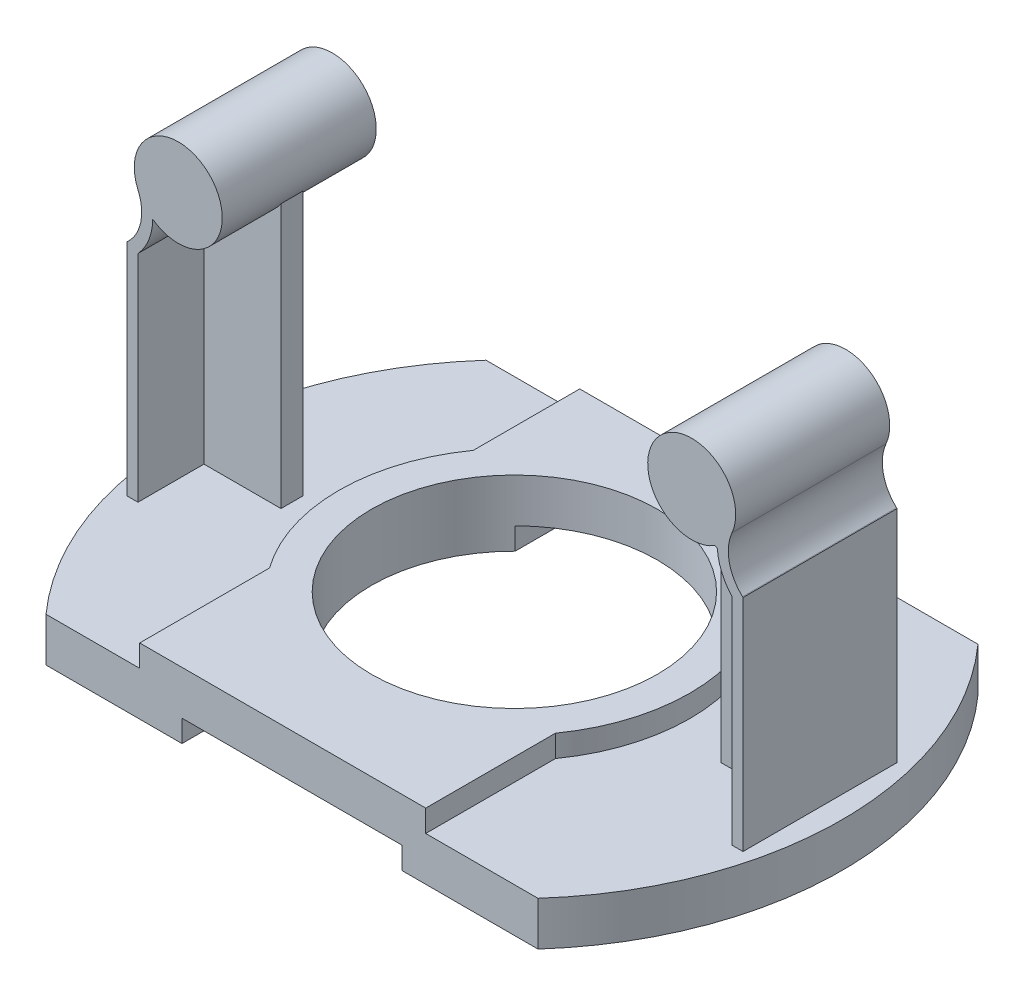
SolidWorks part; units mm, degrees
ref_plane "Plan de face" through (0, 0, 0) normal (0, 0, 1) x (1, 0, 0)
ref_plane "Plan de dessus" through (0, 0, 0) normal (0, 1, 0) x (1, 0, 0)
ref_plane "Plan de droite" through (0, 0, 0) normal (1, 0, 0) x (0, 0, -1)
sketch "Esquisse1" plane through (0, 0, 0) normal (0, 0, 1) x (1, 0, 0)
  line L0 (-14, 0) -> (-10, 0)
  line L1 (-14, 0) -> (-14, 10)
  line L2 (-14, 10) -> (-12.5685, 11.3164)
  line L3 (-10, 0) -> (-10, 12)
  line L4 (10, 0) -> (10, 12)
  line L5 (14, 10) -> (12.5685, 11.3164)
  line L6 (0, 12) -> (0, -7.2956) construction
  line L7 (14, 0) -> (14, 10)
  line L8 (14, 0) -> (10, 0)
  arc A0 (-10, 12) -> (-12.5685, 11.3164) centre (-11.6687, 13.1025) ccw
  arc A1 (10, 12) -> (12.5685, 11.3164) centre (11.6687, 13.1025) cw
  dimension "D1" = 4
  dimension "D2" = 4
  dimension "D3" = 10
  dimension "D4" = 12
  dimension "D5" = 14
extrude "Boss.-Extru.1" add sketch "Esquisse1" along normal blind 7
fillet "Congé1" radius 2 1 edges at (-12.5685, 11.3164, 3.5)
sketch "Esquisse2" plane through (0, 0, 7) normal (0, 0, 1) x (1, 0, 0)
  line L0 (-10, 12) -> (-10, 0)
  line L1 (-10, 0) -> (-13.5, 0)
  line L2 (-13.5, 10) -> (-13.5, 0)
  line L3 (-13.5, 9.7909) -> (-13.5, 0)
  line L4 (0, 15.4181) -> (0, -6.3433) construction
  line L5 (-10, 0) -> (-10, 12) construction
  arc A1 (-12.8308, 11.4748) -> (-10, 12) centre (-11.6687, 13.1025) ccw
  arc A2 (-13.6385, 9.6532) -> (-13.0419, 12.4991) centre (-15.3307, 11.4934) ccw
  arc A3 (-13.5, 9.7909) -> (-12.8308, 11.4748) centre (-15.3307, 11.4934) ccw
  dimension "D3" = 4
  dimension "D1" = 0.5
  dimension "D2" = 0.5
extrude "Enlèv. mat.-Extru.2" cut sketch "Esquisse2" against normal blind 3
sketch "Esquisse5" plane through (0, 0, 0) normal (0, 0, -1) x (-1, 0, 0)
  line L6 (13.5, 0) -> (13.5, 9.7909)
  line L7 (10, 0) -> (13.5, 0)
  line L8 (10, 12) -> (10, 0)
  line L9 (13.5, 0) -> (13.5, 9.7909)
  line L10 (10, 0) -> (13.5, 0)
  line L11 (10, 12) -> (10, 0)
  arc A5 (12.8308, 11.4748) -> (13.5, 9.7909) centre (15.3307, 11.4934) ccw
  arc A6 (12.8308, 11.4748) -> (13.5, 9.7909) centre (15.3307, 11.4934) ccw
  arc A7 (10, 12) -> (12.8308, 11.4748) centre (11.6687, 13.1025) ccw
  arc A8 (10, 12) -> (12.8308, 11.4748) centre (11.6687, 13.1025) ccw
  dimension "D1" = 0
extrude "Enlèv. mat.-Extru.3" cut sketch "Esquisse5" against normal blind 3
fillet "Congé3" radius 2 1 edges at (12.5685, 11.3164, 3.5)
sketch "Esquisse6" plane through (0, 0, 7) normal (0, 0, 1) x (1, 0, 0)
  line L0 (0, 14.8412) -> (0, -11.2056) construction
  line L1 (10, 0) -> (10, 12)
  line L2 (13.5, 0) -> (10, 0)
  line L3 (13.5, 9.7909) -> (13.5, 0)
  line L4 (-13.5, 9.7909) -> (-13.5, 0)
  line L5 (-13.5, 0) -> (-10, 0)
  line L6 (-10, 0) -> (-10, 12)
  line L7 (-13.5, 9.7909) -> (-13.5, 0)
  line L8 (-13.5, 0) -> (-10, 0)
  line L9 (-10, 0) -> (-10, 12)
  arc A0 (12.6876, 11.3833) -> (12.8382, 11.3049) centre (12.7385, 11.2972) cw
  arc A1 (12.6876, 11.3833) -> (10, 12) centre (11.6687, 13.1074) cw
  arc A2 (13.5, 9.7909) -> (12.8382, 11.3049) centre (15.3311, 11.4929) cw
  arc A3 (-13.5, 9.7909) -> (-12.8308, 11.4748) centre (-15.3307, 11.4934) ccw
  arc A4 (-13.5, 9.7909) -> (-12.8308, 11.4748) centre (-15.3307, 11.4934) ccw
  arc A5 (-12.8308, 11.4748) -> (-10, 12) centre (-11.6687, 13.1025) ccw
  arc A6 (-12.8308, 11.4748) -> (-10, 12) centre (-11.6687, 13.1025) ccw
  dimension "D1" = 0
extrude "Enlèv. mat.-Extru.4" cut sketch "Esquisse6" against normal blind 3
sketch "Esquisse7" plane through (0, 0, 0) normal (0, 0, -1) x (-1, 0, 0)
  line L3 (-10, 0) -> (-10, 12)
  line L4 (-13.5, 0) -> (-10, 0)
  line L5 (-13.5, 9.7909) -> (-13.5, 0)
  line L6 (-10, 0) -> (-10, 12)
  line L7 (-13.5, 0) -> (-10, 0)
  line L8 (-13.5, 9.7909) -> (-13.5, 0)
  arc A3 (-12.6876, 11.3833) -> (-10, 12) centre (-11.6687, 13.1074) ccw
  arc A4 (-13.5, 9.7909) -> (-12.8382, 11.3049) centre (-15.3311, 11.4929) ccw
  arc A5 (-12.6876, 11.3833) -> (-12.8382, 11.3049) centre (-12.7385, 11.2972) ccw
  arc A6 (-12.6876, 11.3833) -> (-10, 12) centre (-11.6687, 13.1074) ccw
  arc A7 (-13.5, 9.7909) -> (-12.8382, 11.3049) centre (-15.3311, 11.4929) ccw
  arc A8 (-12.6876, 11.3833) -> (-12.8382, 11.3049) centre (-12.7385, 11.2972) ccw
  dimension "D1" = 0
extrude "Enlèv. mat.-Extru.5" cut sketch "Esquisse7" against normal blind 3
sketch "Esquisse8" plane through (0, 0, 0) normal (0, -1, 0) x (1, 0, 0)
  line L0 (-11.1803, -6.5) -> (11.1803, -6.5)
  line L1 (-11.1803, 13.5) -> (11.1803, 13.5)
  arc A0 (11.1803, -6.5) -> (11.1803, 13.5) centre (0, 3.5) ccw
  arc A1 (-11.1803, 13.5) -> (-11.1803, -6.5) centre (0, 3.5) ccw
  dimension "D1" = 30
  dimension "D2" = 3.5
  dimension "D3" = 20
  dimension "D4" = 10
extrude "Boss.-Extru.2" add sketch "Esquisse8" along normal blind 2
sketch "Esquisse9" plane through (0, 0, 13.5) normal (0, 0, 1) x (1, 0, 0)
  line L0 (11.1803, 0) -> (-11.1803, 0) construction
  line L1 (-5, -1) -> (5, -1)
  line L2 (-5, -1) -> (-5, -2.9545)
  line L3 (-5, -2.9545) -> (5, -2.9545)
  line L4 (5, -1) -> (5, -2.9545)
  line L5 (11.1803, -2) -> (-11.1803, -2) construction
  point P4 (0, 0)
  point P7 (0, 0)
  dimension "D1" = 5
  dimension "D2" = 5
  dimension "D3" = 1
extrude "Enlèv. mat.-Extru.6" cut sketch "Esquisse9" against normal through all
sketch "Esquisse10" plane through (0, 0, 0) normal (0, 1, 0) x (1, 0, 0)
  line L0 (11.1803, -13.5) -> (-11.1803, -13.5) construction
  line L2 (-6.9216, 6.5) -> (6.0784, 6.5)
  line L3 (-6.9216, 6.5) -> (-6.9216, 1.6614)
  line L4 (-6.9216, -13.5) -> (6.0784, -13.5)
  line L5 (6.0784, 6.5) -> (6.0784, 1.6614)
  line L6 (6.0784, -7.6018) -> (6.0784, -13.5)
  line L7 (-6.9216, -7.6018) -> (-6.9216, -13.5)
  circle A0 centre (-0.4216, -2.9702) radius 6.5
  arc A1 (6.0784, -7.6018) -> (6.0784, 1.6614) centre (-0.4216, -2.9702) ccw
  arc A2 (-6.9216, 1.6614) -> (-6.9216, -7.6018) centre (-0.4216, -2.9702) ccw
  dimension "D2" = 13
  dimension "D1" = 3
  dimension "D3" = 6.5
  dimension "D4" = 6.5
  dimension "D5" = 20
extrude "Boss.-Extru.3" add sketch "Esquisse10" along normal blind 1
sketch "Esquisse12" plane through (0, 0, 0) normal (0, 1, 0) x (1, 0, 0)
  circle A1 centre (-0.4216, -2.9702) radius 6.5
  circle A2 centre (-0.4216, -2.9702) radius 6.5
  dimension "D1" = 0
extrude "Enlèv. mat.-Extru.7" cut sketch "Esquisse12" against normal blind 21
